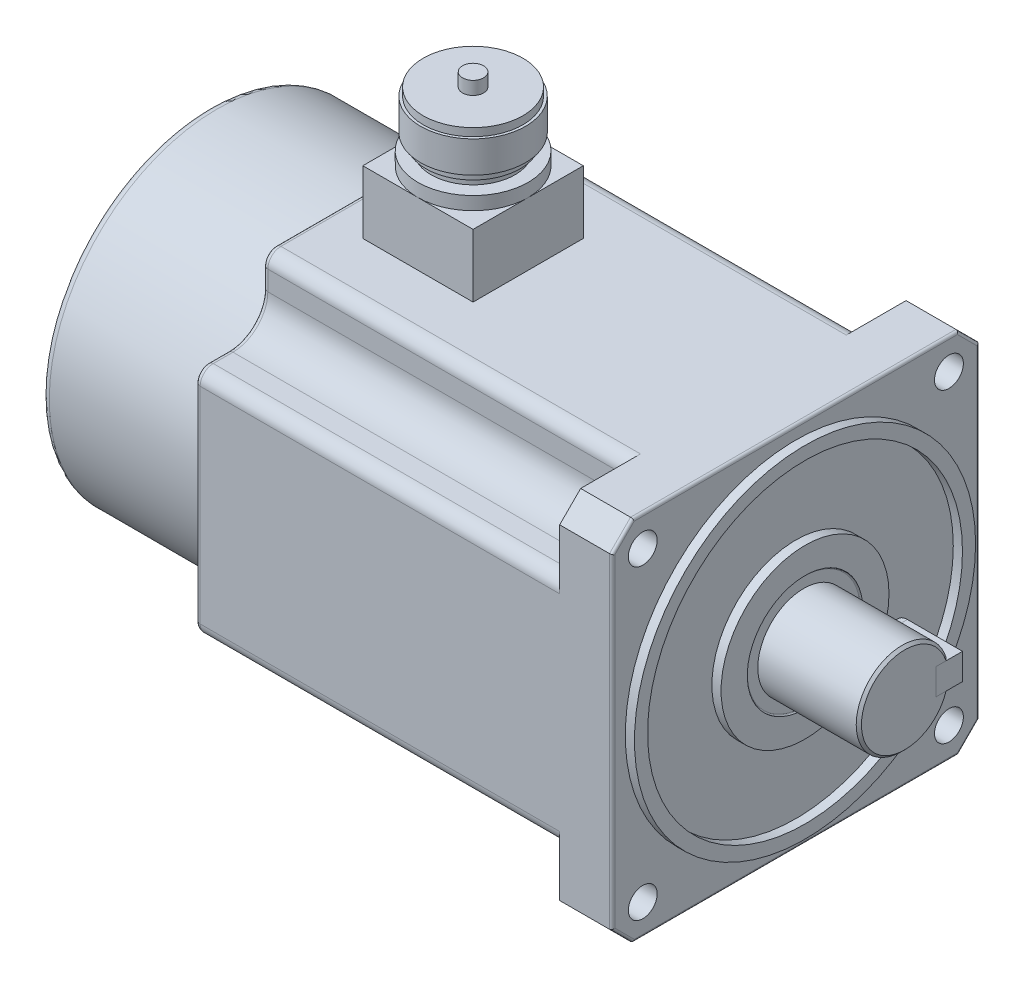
SolidWorks part; units mm, degrees
ref_plane "前视基准面" through (0, 0, 0) normal (0, 0, 1) x (1, 0, 0)
ref_plane "上视基准面" through (0, 0, 0) normal (0, 1, 0) x (1, 0, 0)
ref_plane "右视基准面" through (0, 0, 0) normal (1, 0, 0) x (0, 0, -1)
sketch "草图1" plane through (0, 0, 0) normal (1, 0, 0) x (0, 0, -1)
  line L0 (-70, 62) -> (-62, 70)
  line L1 (-62, -70) -> (62, -70)
  line L2 (-70, -62) -> (-70, 62)
  line L3 (-62, 70) -> (62, 70)
  line L4 (70, -62) -> (70, 62)
  line L5 (-70, -70) -> (70, 70) construction
  line L6 (-70, 70) -> (70, -70) construction
  line L7 (-62, -70) -> (-70, -62)
  line L8 (62, -70) -> (70, -62)
  line L9 (70, 62) -> (62, 70)
  point P0 (0, 0)
extrude "凸台-拉伸1" add sketch "草图1" against normal blind 159
sketch "草图2" plane through (-159, 0, 0) normal (-1, 0, 0) x (0, 0, 1)
  line L0 (-57.5, 44.2147) -> (-65, 44.2147)
  line L1 (-70, -62) -> (-70, 62) construction
  line L3 (-65, -44.2147) -> (-57.5, -44.2147)
  line L4 (-70, 39.2147) -> (-70, 62)
  line L5 (-44.2147, -57.5) -> (-44.2147, -65)
  line L6 (62, -70) -> (-62, -70) construction
  line L8 (44.2147, -65) -> (44.2147, -57.5)
  line L9 (-70, 62) -> (-62, 70)
  line L10 (57.5, -44.2147) -> (65, -44.2147)
  line L11 (70, 62) -> (70, -62) construction
  line L13 (65, 44.2147) -> (57.5, 44.2147)
  line L14 (-62, 70) -> (-39.2147, 70)
  line L15 (44.2147, 57.5) -> (44.2147, 65)
  line L16 (-62, 70) -> (62, 70) construction
  line L18 (-44.2147, 65) -> (-44.2147, 57.5)
  line L19 (39.2147, 70) -> (62, 70)
  line L20 (62, 70) -> (70, 62)
  line L21 (70, 62) -> (70, 39.2147)
  line L22 (70, -39.2147) -> (70, -62)
  line L23 (70, -62) -> (62, -70)
  line L24 (62, -70) -> (39.2147, -70)
  line L25 (-39.2147, -70) -> (-62, -70)
  line L26 (-62, -70) -> (-70, -62)
  line L27 (-70, -62) -> (-70, -39.2147)
  arc A0 (-57.5, 44.2147) -> (-44.2147, 57.5) centre (-57.5, 57.5) ccw
  arc A1 (44.2147, 57.5) -> (57.5, 44.2147) centre (57.5, 57.5) ccw
  arc A2 (57.5, -44.2147) -> (44.2147, -57.5) centre (57.5, -57.5) ccw
  arc A3 (-44.2147, -57.5) -> (-57.5, -44.2147) centre (-57.5, -57.5) ccw
  arc A4 (-65, 44.2147) -> (-70, 39.2147) centre (-65, 39.2147) ccw
  arc A5 (-70, -39.2147) -> (-65, -44.2147) centre (-65, -39.2147) ccw
  arc A6 (-44.2147, -65) -> (-39.2147, -70) centre (-39.2147, -65) ccw
  arc A7 (39.2147, -70) -> (44.2147, -65) centre (39.2147, -65) ccw
  arc A8 (65, -44.2147) -> (70, -39.2147) centre (65, -39.2147) ccw
  arc A9 (70, 39.2147) -> (65, 44.2147) centre (65, 39.2147) ccw
  arc A10 (44.2147, 65) -> (39.2147, 70) centre (39.2147, 65) ccw
  arc A11 (-39.2147, 70) -> (-44.2147, 65) centre (-39.2147, 65) ccw
  point P0 (0, 0)
  point P10 (-70, 44.2147)
  point P39 (-70, -44.2147)
  point P42 (-44.2147, -70)
  point P45 (44.2147, -70)
  point P48 (70, -44.2147)
  point P51 (70, 44.2147)
  point P54 (44.2147, 70)
  point P57 (-44.2147, 70)
  dimension "D1" = 5
extrude "切除-拉伸1" cut sketch "草图2" against normal blind 139
fillet "圆角1" radius 2 24 edges at (-159, 48.1059, 48.1059) (-159, 44.2147, 61.25) (-159, 42.7502, 68.5355) (-159, 0, 70) (-159, -42.7502, 68.5355) (-159, -44.2147, 61.25) (-159, -48.1059, 48.1059) (-159, -61.25, 44.2147) (-159, -68.5355, 42.7502) (-159, -70, 0) (-159, -68.5355, -42.7502) (-159, -61.25, -44.2147) (-159, -48.1059, -48.1059) (-159, -44.2147, -61.25) (-159, -42.7502, -68.5355) (-159, 0, -70) (-159, 42.7502, -68.5355) (-159, 44.2147, -61.25) (-159, 48.1059, -48.1059) (-159, 61.25, -44.2147) (-159, 68.5355, -42.7502) (-159, 70, 0) (-159, 68.5355, 42.7502) (-159, 61.25, 44.2147)
fillet "圆角2" radius 1 8 edges at (0, 66, -66) (0, 0, -70) (0, -66, -66) (0, -70, 0) (0, -66, 66) (0, 0, 70) (0, 66, 66) (0, 70, 0)
sketch "草图4" plane through (0, 0, 0) normal (1, 0, 0) x (0, 0, -1)
  circle A1 centre (-58.3363, 58.3363) radius 5.5
  circle A2 centre (58.3363, 58.3363) radius 5.5
  circle A3 centre (58.3363, -58.3363) radius 5.5
  circle A4 centre (-58.3363, -58.3363) radius 5.5
extrude "切除-拉伸2" cut sketch "草图4" against normal blind 20
sketch "草图5" plane through (0, 0, 0) normal (1, 0, 0) x (0, 0, -1)
  circle A0 centre (0, 0) radius 60
  circle A1 centre (0, 0) radius 65
extrude "凸台-拉伸2" add sketch "草图5" along normal blind 3.5
sketch "草图6" plane through (0, 0, 0) normal (1, 0, 0) x (0, 0, -1)
  circle A0 centre (0, 0) radius 32
extrude "凸台-拉伸3" add sketch "草图6" along normal blind 3.5
sketch "草图7" plane through (3.5, 0, 0) normal (1, 0, 0) x (0, 0, -1)
  circle A0 centre (0, 0) radius 22
extrude "切除-拉伸3" cut sketch "草图7" against normal blind 0.5
fillet "圆角3" radius 0.5 1 edges at (3, 0, -22)
sketch "草图8" plane through (3, 0, 0) normal (1, 0, 0) x (0, 0, -1)
  circle A0 centre (0, 0) radius 17.5
extrude "凸台-拉伸4" add sketch "草图8" along normal blind 38.5
ref_plane "基准面1" through (0, 0, -17.5) normal (0, 0, 1) x (1, 0, 0)
sketch "草图9" plane through (0, 0, -17.5) normal (0, 0, 1) x (1, 0, 0)
  line L1 (41.5, -17.5) -> (41.5, 17.5) construction
  line L2 (20.5, 5) -> (41.5, 5)
  line L3 (41.5, 5) -> (41.5, -5)
  line L4 (41.5, -5) -> (20.5, -5)
  arc A0 (20.5, 5) -> (20.5, -5) centre (20.5, 0) ccw
extrude "切除-拉伸4" cut sketch "草图9" along normal blind 5.5
sketch "草图10" plane through (0, 0, -12) normal (0, 0, -1) x (-1, 0, 0)
  line L0 (-20.5, 5) -> (-41.5, 5)
  line L1 (-41.5, 5) -> (-41.5, -5)
  line L2 (-41.5, -5) -> (-20.5, -5)
  arc A0 (-20.5, -5) -> (-20.5, 5) centre (-20.5, 0) ccw
extrude "凸台-拉伸5" add sketch "草图10" along normal blind 10 separate body
sketch "草图11" plane through (-159, 0, 0) normal (-1, 0, 0) x (0, 0, 1)
  circle A0 centre (0, 0) radius 64
extrude "凸台-拉伸6" add sketch "草图11" along normal blind 64.5
fillet "圆角4" radius 3 1 edges at (-223.5, 0, 64)
chamfer "倒角1" distance 1 angle 45 1 edges at (41.5, 0, 17.5)
sketch "草图12" plane through (0, 70, 0) normal (0, 1, 0) x (1, 0, 0)
  line L3 (-144, -21) -> (-102, -21)
  line L4 (-144, -21) -> (-144, 21)
  line L5 (-144, 21) -> (-102, 21)
  line L6 (-102, -21) -> (-102, 21)
  line L7 (-144, -21) -> (-102, 21) construction
  line L8 (-144, 21) -> (-102, -21) construction
extrude "凸台-拉伸7" add sketch "草图12" along normal blind 24
sketch "草图13" plane through (0, 94, 0) normal (0, 1, 0) x (1, 0, 0)
  circle A0 centre (-123, 0) radius 21
extrude "凸台-拉伸8" add sketch "草图13" along normal blind 5
sketch "草图14" plane through (0, 99, 0) normal (0, 1, 0) x (1, 0, 0)
  circle A0 centre (-123, 0) radius 16
extrude "凸台-拉伸9" add sketch "草图14" along normal blind 3
sketch "草图15" plane through (0, 102, 0) normal (0, 1, 0) x (1, 0, 0)
  circle A0 centre (-123, 0) radius 18
extrude "凸台-拉伸10" add sketch "草图15" along normal blind 3
sketch "草图16" plane through (0, 105, 0) normal (0, 1, 0) x (1, 0, 0)
  circle A0 centre (-123, 0) radius 20
extrude "凸台-拉伸11" add sketch "草图16" along normal blind 12
sketch "草图17" plane through (0, 117, 0) normal (0, 1, 0) x (1, 0, 0)
  circle A0 centre (-123, 0) radius 19
extrude "凸台-拉伸12" add sketch "草图17" along normal blind 3
sketch "草图18" plane through (0, 120, 0) normal (0, 1, 0) x (1, 0, 0)
  circle A0 centre (-123, 0) radius 4
extrude "凸台-拉伸13" add sketch "草图18" along normal blind 5
